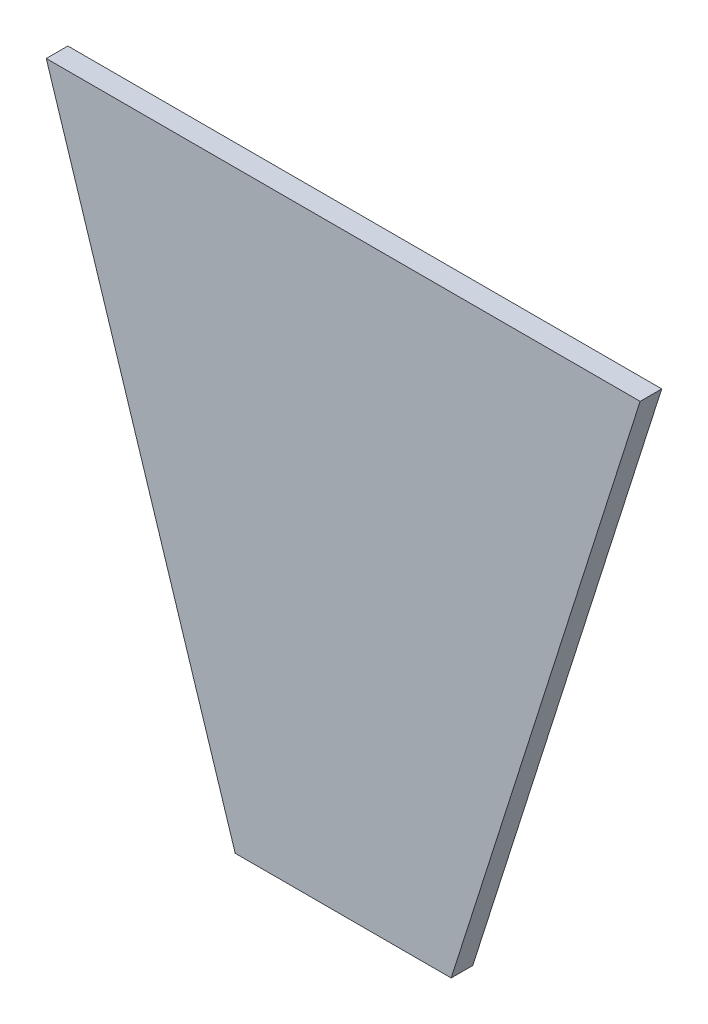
SolidWorks part; units mm, degrees
ref_plane "Face" through (0, 0, 0) normal (0, 0, 1) x (1, 0, 0)
ref_plane "Dessus" through (0, 0, 0) normal (0, 1, 0) x (1, 0, 0)
ref_plane "Droite" through (0, 0, 0) normal (1, 0, 0) x (0, 0, -1)
sketch "Esquisse1" plane through (0, 0, 0) normal (0, 0, 1) x (1, 0, 0)
  line L0 (0, 0) -> (220, 0)
  line L1 (220, 0) -> (150, -220)
  line L2 (150, -220) -> (70, -220)
  line L3 (70, -220) -> (0, 0)
  dimension "D1" = 220
  dimension "D2" = 220
  dimension "D3" = 80
  dimension "D4" = 70
extrude "Base-Extrusion" add sketch "Esquisse1" along normal blind 8
